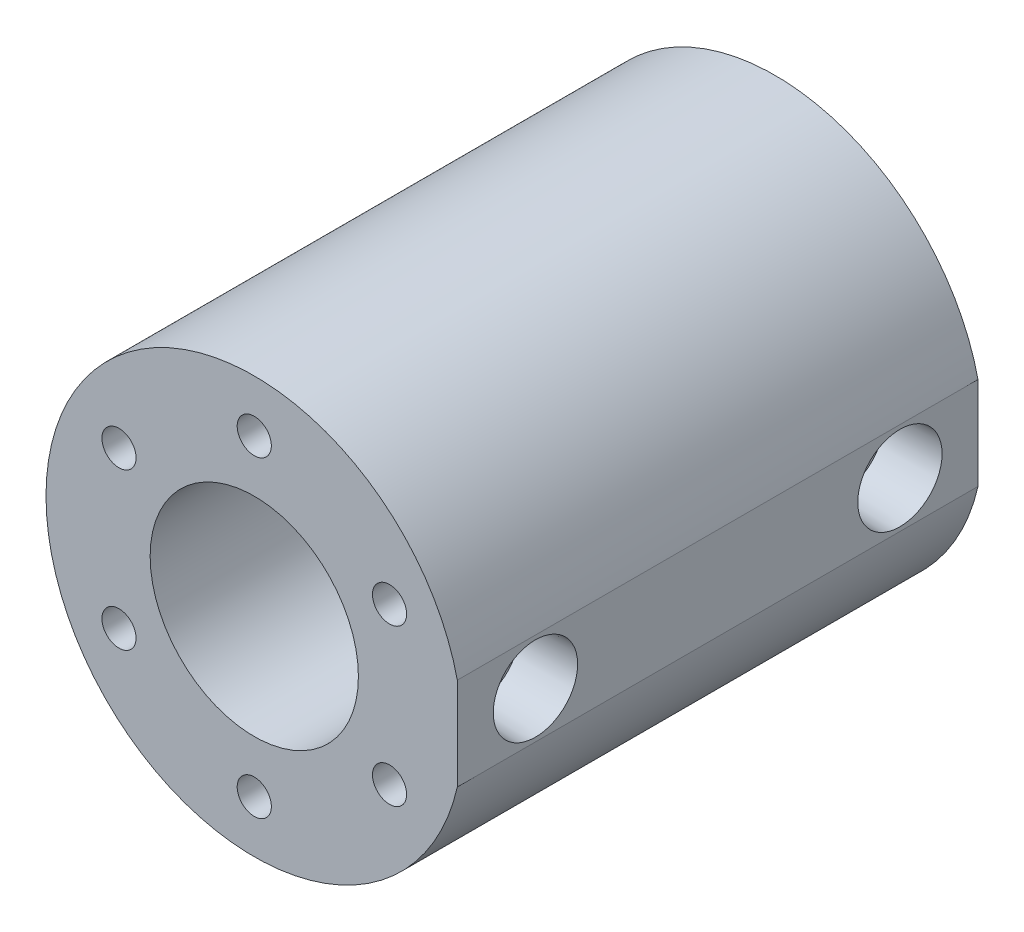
SolidWorks part; units mm, degrees
ref_plane "Front Plane" through (0, 0, 0) normal (0, 0, 1) x (1, 0, 0)
ref_plane "Top Plane" through (0, 0, 0) normal (0, 1, 0) x (1, 0, 0)
ref_plane "Right Plane" through (0, 0, 0) normal (1, 0, 0) x (0, 0, -1)
sketch "Sketch1" plane through (0, 0, 0) normal (0, 0, 1) x (1, 0, 0)
  line L0 (24.765, 5.644) -> (24.765, -5.644)
  circle A0 centre (0, 0) radius 12.7
  arc A1 (24.765, 5.644) -> (24.765, -5.644) centre (0, 0) ccw
  dimension "D1" = 25.4
  dimension "D2" = 50.8
  dimension "D3" = 24.765
extrude "Extrude1" add sketch "Sketch1" along normal mid plane 63.5
hole_wizard "#8-32 Tapped Hole1" positions "Sketch8" profile "Sketch7" tap size "#8-32" standard "Ansi Inch"
sketch "Sketch8" plane through (0, 0, 31.75) normal (0, 0, 1) x (1, 0, 0)
  line L0 (0, 0) -> (16.4978, 9.525) construction
  line L1 (0, 0) -> (0, 19.05) construction
  line L3 (0, 0) -> (31.4646, 0) construction
  circle A0 centre (0, 0) radius 19.05 construction
  point P0 (-16.4978, -9.525)
  point P1 (16.4978, 9.525)
  point P3 (0, 19.05)
  point P5 (-16.4978, 9.525)
  point P7 (0, -19.05)
  point P9 (16.4978, -9.525)
  dimension "D2" = 38.1
  dimension "D1" = 60
sketch "Sketch7" plane through (-16.4978, -9.525, 31.75) normal (1, 0, 0) x (0, -1, 0)
  line L0 (0, 0) -> (0, 21.2054)
  line L1 (0, 21.2054) -> (1.7272, 20.1676)
  line L2 (1.7272, 20.1676) -> (1.7272, 17.78)
  line L3 (1.7272, 17.78) -> (2.0828, 17.78)
  line L4 (2.0828, 17.78) -> (2.0828, 0)
  line L5 (2.0828, 0) -> (0, 0)
  line L10 (0, 21.2054) -> (-1.7272, 20.1676) construction
  line L11 (0, -6.35) -> (0, 107.95) construction
  dimension "Tap Drill Dia." = 3.4544
  dimension "Tap Drill Depth" = 20.1676
  dimension "Thread Major Dia." = 4.1656
  dimension "Thread Depth" = 17.78
  dimension "Drill Angle" = 118
mirror "Mirror1" about plane through (0, 0, 0) normal (0, 0, 1) of "#8-32 Tapped Hole1"
hole_wizard "Steam Holes" positions "Sketch10" profile "Sketch9" size "1/8" standard "Ansi Inch"
sketch "Sketch10" plane through (24.765, 0, 0) normal (1, 0, 0) x (0, 0, -1)
  line L0 (0, 0) -> (0, 30.4183) construction
  point P0 (22.225, 0)
  point P1 (-22.225, 0)
  dimension "D1" = 44.45
sketch "Sketch9" plane through (24.765, 0, -22.225) normal (0, 1, 0) x (0, 0, -1)
  line L0 (0, 0) -> (0, 11.4235)
  line L1 (4.2164, 8.89) -> (0, 11.4235)
  line L2 (-4.2164, 8.89) -> (0, 11.4235) construction
  line L3 (4.2164, 8.89) -> (4.2164, 6.924)
  line L4 (4.2164, 6.924) -> (4.9362, 6.924)
  line L5 (4.9362, 6.924) -> (5.1435, 0)
  line L6 (-4.9362, 6.924) -> (-5.1435, 0) construction
  line L7 (5.1435, 0) -> (0, 0)
  line L8 (0, -6.35) -> (0, 107.95) construction
  line L11 (-4.2164, 6.924) -> (-4.9362, 6.924) construction
  dimension "Tap Drill Dia." = 8.4328
  dimension "Tap Drill Depth" = 8.89
  dimension "Thread Dia." = 10.287
  dimension "Thread Angle" = 3.43
  dimension "Thread Depth" = 6.924
  dimension "Drill Angle" = 118
sketch "Sketch11" plane through (24.765, 0, 0) normal (1, 0, 0) x (0, 0, -1)
  circle A0 centre (22.225, 0) radius 3.175
  circle A1 centre (-22.225, 0) radius 3.175
  circle A3 centre (22.225, 0) radius 5.1435 construction
  circle A4 centre (-22.225, 0) radius 4.9362 construction
  dimension "D1" = 6.35
extrude "Cut-Extrude1" cut sketch "Sketch11" against normal up to next
